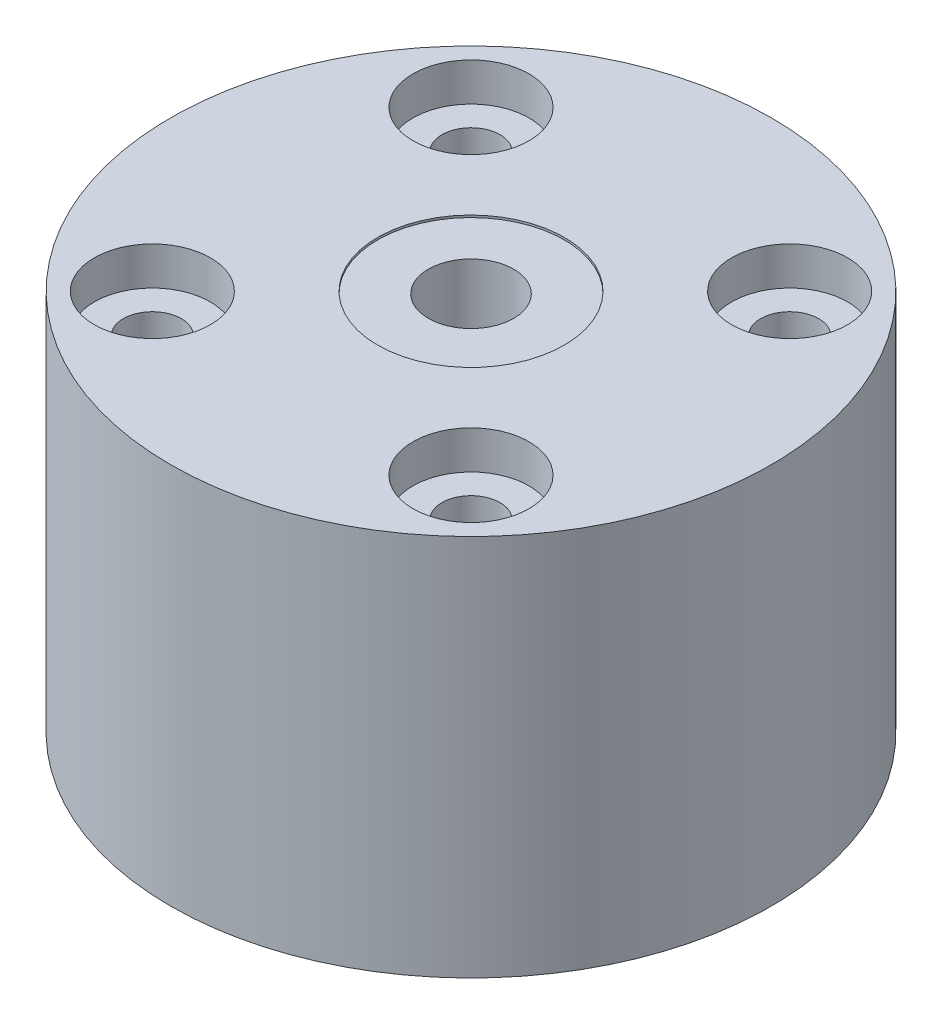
SolidWorks part; units mm, degrees
ref_plane "Front Plane" through (0, 0, 0) normal (0, 0, 1) x (1, 0, 0)
ref_plane "Top Plane" through (0, 0, 0) normal (0, 1, 0) x (1, 0, 0)
ref_plane "Right Plane" through (0, 0, 0) normal (1, 0, 0) x (0, 0, -1)
sketch "Sketch1" plane through (0, 0, 0) normal (0, 1, 0) x (1, 0, 0)
  circle A0 centre (0, 0) radius 34.925
  dimension "D1" = 69.85
extrude "Boss-Extrude1" add sketch "Sketch1" against normal blind 44.45
sketch "Sketch8" plane through (0, -44.45, 0) normal (0, -1, 0) x (1, 0, 0)
  circle A0 centre (0, 0) radius 14.8451
extrude "Cut-Extrude1" cut sketch "Sketch8" against normal blind 18.2562
hole_wizard "CBORE for 1/4 Pan Head Machine Screw1" positions "Sketch5" profile "Sketch4" counterbore size "1/4" standard "ANSI Inch"
sketch "Sketch5" plane through (-17.1422, 0, 2.0044) normal (0, -1, 0) x (1, 0, 0)
  line L0 (17.1422, -2.0044) -> (17.1422, 40.9477) construction
  line L1 (17.1422, -2.0044) -> (35.6639, 16.5174) construction
  circle A0 centre (17.1422, -2.0044) radius 26.1938 construction
  point P0 (35.6639, 16.5174)
  point P32 (35.6639, -20.5262)
  point P33 (-1.3796, -20.5262)
  point P34 (-1.3796, 16.5174)
  dimension "D1" = 52.3875
  dimension "D2" = 45
  dimension "D3" = 4
sketch "Sketch4" plane through (18.5218, 0, 18.5218) normal (1, 0, 0) x (0, 0, 1)
  line L0 (0, 0) -> (0, 44.45)
  line L1 (0, 44.45) -> (3.3782, 44.45)
  line L3 (3.3782, 44.45) -> (3.3782, 4.445)
  line L4 (3.3782, 4.445) -> (6.7462, 4.445)
  line L5 (6.7462, 4.445) -> (6.7462, 0)
  line L7 (6.7462, 0) -> (0, 0)
  line L11 (0, -6.35) -> (0, 107.95) construction
  dimension "Thru Hole Dia." = 6.7564
  dimension "Thru Hole Depth" = 44.45
  dimension "C'Bore Dia." = 13.4925
  dimension "C'Bore Depth" = 4.445
hole_wizard "7/16-20 Tapped Hole1" positions "Sketch7" profile "Sketch6" tap size "7/16-20" standard "ANSI Inch"
sketch "Sketch7" plane through (0, 0, 0) normal (0, 1, 0) x (-1, 0, 0)
  point P0 (0, 0)
sketch "Sketch6" plane through (0, 0, 0) normal (1, 0, 0) x (0, 0, 1)
  line L0 (0, 0) -> (0, 44.45)
  line L1 (0, 44.45) -> (4.9606, 44.45)
  line L2 (4.9606, 44.45) -> (4.9606, 0)
  line L5 (4.9606, 0) -> (0, 0)
  line L11 (0, -6.35) -> (0, 107.95) construction
  dimension "Thru Tap Drill Dia." = 9.9212
  dimension "Thru Tap Drill Depth" = 44.45
sketch "Sketch9" plane through (0, 0, 0) normal (0, 1, 0) x (1, 0, 0)
  circle A0 centre (0, 0) radius 10.8532
extrude "Spot Face" cut sketch "Sketch9" against normal blind 0.254
equation "\"Buoyancy\"=\"SW-Volume\"*(\"SW-Density\"-.037062)"
